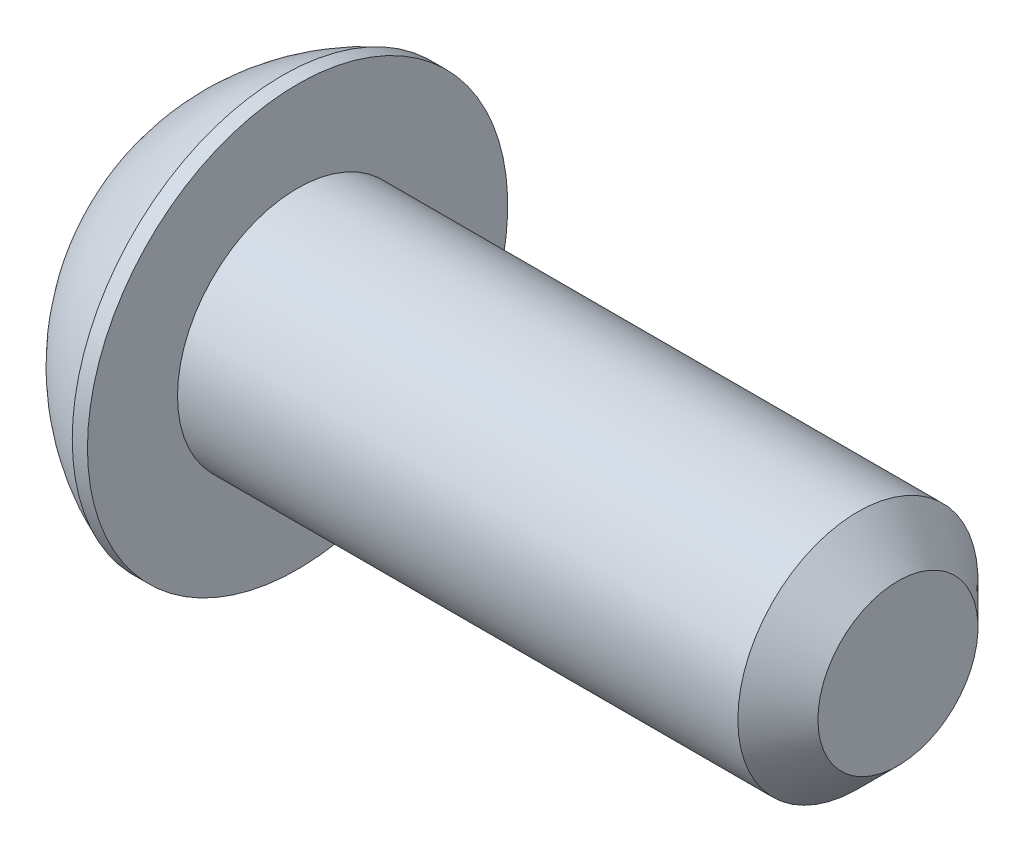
SolidWorks part; units mm, degrees
ref_plane "Plane1" through (0, 0, 0) normal (0, 0, 1) x (1, 0, 0)
ref_plane "Plane2" through (0, 0, 0) normal (0, 1, 0) x (1, 0, 0)
ref_plane "Plane3" through (0, 0, 0) normal (1, 0, 0) x (0, 0, -1)
sketch "BodySke" plane through (0, 0, 0) normal (0, 0, 1) x (1, 0, 0)
  line L0 (18.3, 0) -> (18.3, 2)
  line L1 (17.3, 3) -> (3.3, 3)
  line L2 (3.3, 3) -> (3.3, 5.25)
  line L3 (3.3, 5.25) -> (2.92, 5.25)
  line L4 (0, 0) -> (101.6, 0) construction
  line L5 (3.3, -5.25) -> (2.92, -5.25) construction
  line L6 (55.6768, -3) -> (3.3, -3) construction
  line L7 (18.3, 0) -> (0, 0)
  line L8 (0, 2.625) -> (0, -2.625) construction
  line L9 (0, 0) -> (0, 2.625)
  line L10 (18.3, 2) -> (17.3, 3)
  line L11 (18.3, -2) -> (17.3, -3) construction
  line L12 (4.3, 9.525) -> (4.3, -3) construction
  line L13 (3.3, 9.525) -> (3.3, -3) construction
  arc A1 (0, 2.625) -> (2.92, 5.25) centre (4.9997, 0) cw
  dimension "D1" = 5.25
  dimension "Diameter" = 6
  dimension "Length" = 15
  dimension "Head_dia" = 10.5
  dimension "Head_ht" = 3.3
  dimension "Head_side_ht" = 0.38
  dimension "Minor_dia" = 4
  dimension "Body_ch_ang" = 45
  dimension "Advance" = 1
  dimension "Thread_nom" = 15
revolve "BaseBody" add sketch "BodySke" angle 360 about L4
fillet "Fillet1" [suppressed] radius 0.25
sketch "Sketch2" plane through (0, 0, 0) normal (0, 0, 1) x (1, 0, 0)
  line L0 (0, 2) -> (2.08, 2)
  line L1 (2.08, 2) -> (3.2347, 0)
  line L3 (3.2347, 0) -> (0, 0)
  line L4 (0, 0) -> (0, 2)
  line L5 (0, -2) -> (2.08, -2) construction
  line L6 (0, 0) -> (47.625, 0) construction
  dimension "D2" = 60
  dimension "PreBroach_depth" = 2.08
  dimension "PreBroach_dia" = 4
revolve "PreBroach" cut sketch "Sketch2" angle 360 about L6
sketch "Sketch3" plane through (0, 0, 0) normal (1, 0, 0) x (0, 0, -1)
  line L0 (-2, -1.1547) -> (-2, 1.1547)
  line L1 (-2, 1.1547) -> (0, 2.3094)
  line L2 (0, 2.3094) -> (2, 1.1547)
  line L3 (2, 1.1547) -> (2, -1.1547)
  line L4 (2, -1.1547) -> (0, -2.3094)
  line L5 (0, -2.3094) -> (-2, -1.1547)
  dimension "D1" = 2
  dimension "D2" = 2
  dimension "D3" = 4
  dimension "Hex_size" = 4
extrude "Hex" cut sketch "Sketch3" along normal blind 2.08
sketch "ThdSchSke" plane through (0, 0, 0) normal (0, 0, 1) x (1, 0, 0)
  line L0 (5.3, -2) -> (4.5998, -3)
  line L1 (5.3, -2) -> (6.0002, -3)
  line L2 (6.0002, -3) -> (6.0002, -3.75)
  line L3 (-3.175, 0) -> (5.1513, 0) construction
  line L5 (6.0002, -3.75) -> (4.5998, -3.75)
  line L6 (4.5998, -3.75) -> (4.5998, -3)
  dimension "Thread_minor" = 4
  dimension "Diameter" = 6
  dimension "Start" = 5.3
  dimension "SideAngle" = 55
  dimension "VeeAngle" = 70
  dimension "Overcut" = 7.5
revolve "ThreadSchematic" [suppressed] cut sketch "ThdSchSke" angle 360 about L3
pattern_linear "ThdSchPat" [suppressed]
equation "\"D1@BodySke\" = \"Head_dia@BodySke\" * .5"
equation "\"Thread_minor@ThreadCosmetic\" = \"Minor_dia@BodySke\""
equation "\"D1@Sketch3\" = \"Hex_size@Sketch3\" / 2"
equation "\"D2@Sketch3\" = \"D1@Sketch3\""
equation "\"D3@Sketch3\" = \"Hex_size@Sketch3\""
equation "\"Thread_length@ThreadCosmetic\" = ((sgn( (\"Length@BodySke\" - \"Advance@BodySke\" * 2.0) - \"Thread_nom@BodySke\" )-1)*( (\"Length@BodySke\" - \"Advance@BodySke\" * 2.0) - \"Thread_nom@BodySke\" ))/-2+ \"Thread_no"
equation "\"Thread_minor@ThdSchSke\" = \"Minor_dia@BodySke\""
equation "\"Diameter@ThdSchSke\" = \"Diameter@BodySke\""
equation "\"Overcut@ThdSchSke\" = \"Diameter@BodySke\" * 1.25"
equation "\"Start@ThdSchSke\" = \"Head_ht@BodySke\" + \"Length@BodySke\" - \"Thread_length@ThreadCosmetic\"  '---Non-countersunk---"
equation "\"Num_threads@ThdSchPat\" = int( \"Thread_length@ThreadCosmetic\" / \"Advance@BodySke\" + 0.999 )  + 1"
equation "\"Advance@ThdSchPat\" = \"Thread_length@ThreadCosmetic\" /  (\"Num_threads@ThdSchPat\" - 1) 'relax it"
equation "\"Num_threads@ThdSchPat\" = \"Num_threads@ThdSchPat\" - sgn( \"Num_threads@ThdSchPat\" - 1) '---chamfered tips only---"
